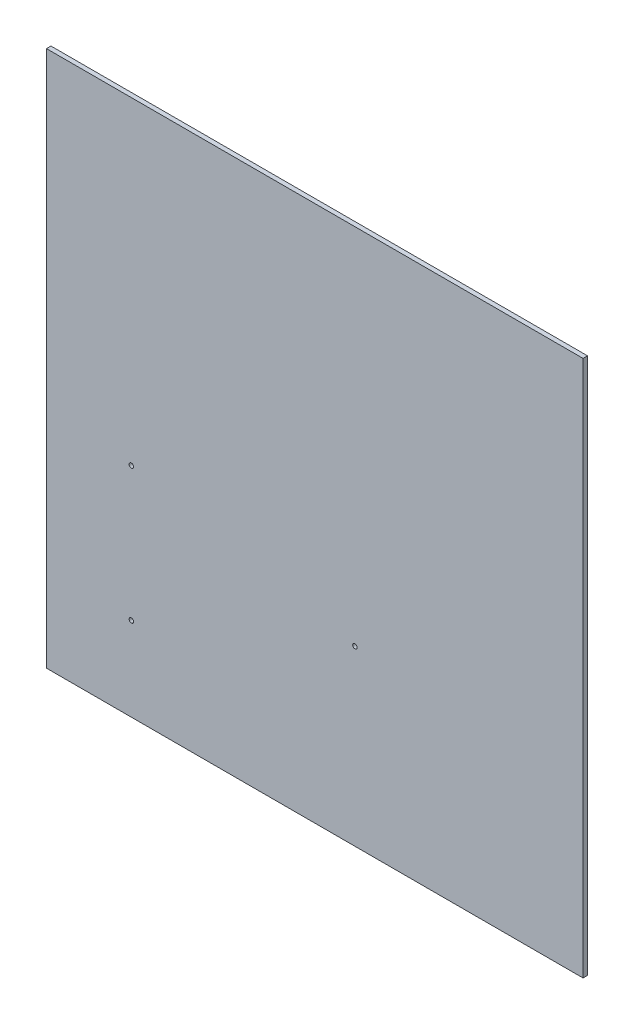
SolidWorks part; units mm, degrees
ref_plane "Front Plane" through (0, 0, 0) normal (0, 0, 1) x (1, 0, 0)
ref_plane "Top Plane" through (0, 0, 0) normal (0, 1, 0) x (1, 0, 0)
ref_plane "Right Plane" through (0, 0, 0) normal (1, 0, 0) x (0, 0, -1)
sketch "Sketch1" plane through (0, 0, 0) normal (0, 0, 1) x (1, 0, 0)
  line L1 (0, 0) -> (304.8, 0)
  line L2 (0, 0) -> (0, 304.8)
  line L3 (0, 304.8) -> (304.8, 304.8)
  line L4 (304.8, 0) -> (304.8, 304.8)
  dimension "D1" = 304.8
  dimension "D2" = 304.8
extrude "Boss-Extrude1" add sketch "Sketch1" along normal blind 2.54
sketch "Sketch2" plane through (0, 0, 2.54) normal (0, 0, 1) x (1, 0, 0)
  circle A2 centre (48.205, 47.5897) radius 1.27
  circle A3 centre (175.205, 98.3897) radius 1.27
  circle A4 centre (48.205, 123.7897) radius 1.27
  dimension "D1" = 2.54
  dimension "D2" = 2.54
  dimension "D3" = 127
  dimension "D4" = 50.8
  dimension "D5" = 76.2
extrude "Cut-Extrude1" cut sketch "Sketch2" against normal through all both and the other way through all
